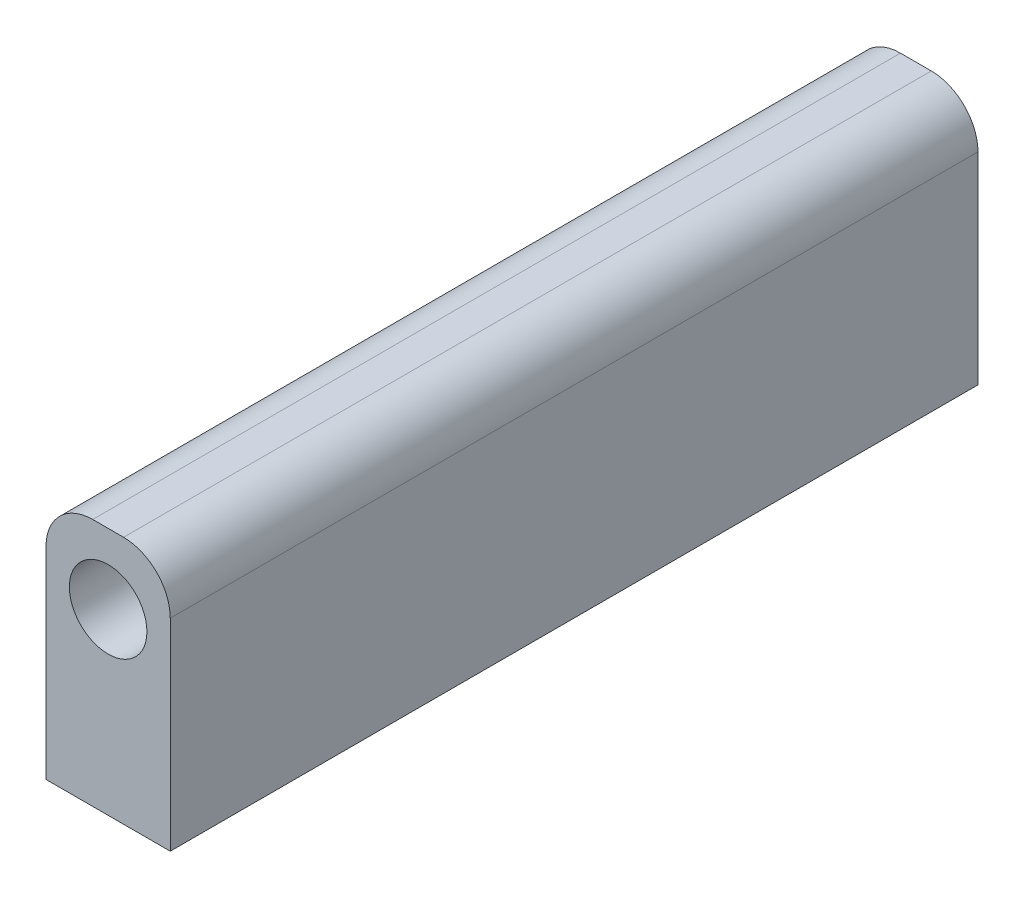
SolidWorks part; units mm, degrees
ref_plane "Front Plane" through (0, 0, 0) normal (0, 0, 1) x (1, 0, 0)
ref_plane "Top Plane" through (0, 0, 0) normal (0, 1, 0) x (1, 0, 0)
ref_plane "Right Plane" through (0, 0, 0) normal (1, 0, 0) x (0, 0, -1)
sketch "Sketch1" plane through (0, 0, 0) normal (0, 0, 1) x (1, 0, 0)
  line L0 (0, 0) -> (6.35, 0)
  line L1 (6.35, 0) -> (6.35, 25.4)
  line L2 (6.35, 25.4) -> (-6.35, 25.4)
  line L3 (-6.35, 25.4) -> (-6.35, 0)
  line L4 (-6.35, 0) -> (0, 0)
  circle A0 centre (0, 18.2372) radius 3.9624
  dimension "D1" = 7.9248
  dimension "D2" = 12.7
  dimension "D3" = 18.2372
  dimension "D4" = 25.4
  dimension "D5" = 7.1628
  dimension "D6" = 14.2748
extrude "Boss-Extrude1" add sketch "Sketch1" along normal mid plane 82.55
sketch "Sketch2" plane through (0, 0, 0) normal (0, 1, 0) x (1, 0, 0)
  line L0 (0, 0) -> (10.8569, 0) construction
  circle A0 centre (0, -31.75) radius 3.9624
  circle A1 centre (0, 31.75) radius 3.9624
  dimension "D1" = 7.9248
  dimension "D2" = 63.5
extrude "Cut-Extrude1" cut sketch "Sketch2" along normal blind 15.875
fillet "Fillet1" radius 4.7752 2 edges at (6.35, 25.4, 0) (-6.35, 25.4, 0)
